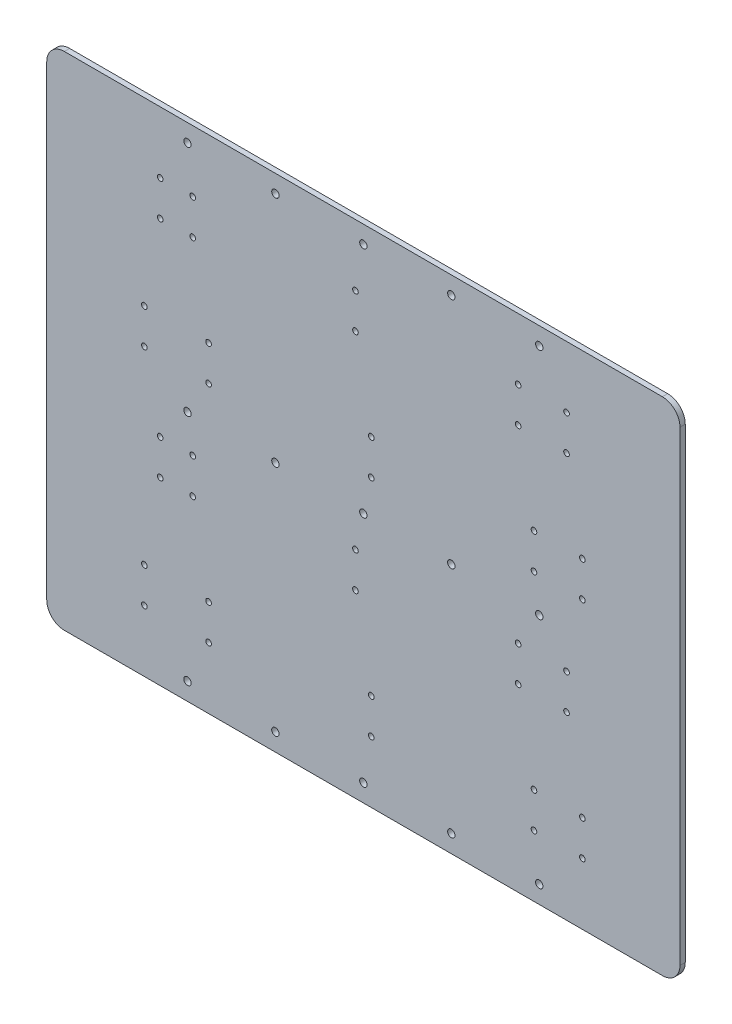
SolidWorks part; units mm, degrees
ref_plane "前视基准面" through (0, 0, 0) normal (0, 0, 1) x (1, 0, 0)
ref_plane "上视基准面" through (0, 0, 0) normal (0, 1, 0) x (1, 0, 0)
ref_plane "右视基准面" through (0, 0, 0) normal (1, 0, 0) x (0, 0, -1)
sketch "草图1" plane through (0, 0, 0) normal (0, 0, 1) x (1, 0, 0)
  line L1 (0, 0) -> (360, 0)
  line L2 (0, 0) -> (0, 275)
  line L3 (0, 275) -> (360, 275)
  line L4 (360, 0) -> (360, 275)
  dimension "D1" = 275
  dimension "D2" = 360
extrude "凸台-拉伸1" add sketch "草图1" along normal blind 3
sketch "草图3" plane through (0, 0, 3) normal (0, 0, 1) x (1, 0, 0)
  line L0 (180, 275) -> (180, 0) construction
  line L1 (360, 275) -> (0, 275) construction
  line L2 (0, 0) -> (360, 0) construction
  line L3 (0, 137.5) -> (360, 137.5) construction
  line L4 (0, 275) -> (0, 0) construction
  line L5 (360, 0) -> (360, 275) construction
  line L6 (300, 275) -> (300, 0) construction
  line L7 (60, 275) -> (60, 0) construction
  line L8 (272.5, 275) -> (272.5, 0) construction
  line L9 (87.5, 275) -> (87.5, 0) construction
  circle A0 centre (175.5, 245) radius 1.6
  circle A1 centre (175.5, 225) radius 1.6
  circle A2 centre (184.5, 177.5) radius 1.6
  circle A3 centre (184.5, 157.5) radius 1.6
  circle A4 centre (184.5, 30) radius 1.6
  circle A5 centre (184.5, 50) radius 1.6
  circle A6 centre (175.5, 97.5) radius 1.6
  circle A7 centre (175.5, 117.5) radius 1.6
  circle A8 centre (295.5, 245) radius 1.6
  circle A9 centre (295.5, 225) radius 1.6
  circle A10 centre (304.5, 177.5) radius 1.6
  circle A11 centre (304.5, 157.5) radius 1.6
  circle A12 centre (304.5, 30) radius 1.6
  circle A13 centre (304.5, 50) radius 1.6
  circle A14 centre (295.5, 97.5) radius 1.6
  circle A15 centre (295.5, 117.5) radius 1.6
  circle A16 centre (64.5, 117.5) radius 1.6
  circle A17 centre (64.5, 97.5) radius 1.6
  circle A18 centre (55.5, 50) radius 1.6
  circle A19 centre (55.5, 30) radius 1.6
  circle A20 centre (55.5, 157.5) radius 1.6
  circle A21 centre (55.5, 177.5) radius 1.6
  circle A22 centre (64.5, 225) radius 1.6
  circle A23 centre (64.5, 245) radius 1.6
  circle A56 centre (268, 245) radius 1.6
  circle A57 centre (268, 225) radius 1.6
  circle A58 centre (277, 177.5) radius 1.6
  circle A59 centre (277, 157.5) radius 1.6
  circle A60 centre (277, 30) radius 1.6
  circle A61 centre (277, 50) radius 1.6
  circle A62 centre (268, 97.5) radius 1.6
  circle A63 centre (268, 117.5) radius 1.6
  circle A64 centre (83, 245) radius 1.6
  circle A65 centre (83, 225) radius 1.6
  circle A66 centre (92, 177.5) radius 1.6
  circle A67 centre (92, 157.5) radius 1.6
  circle A68 centre (92, 30) radius 1.6
  circle A69 centre (92, 50) radius 1.6
  circle A70 centre (83, 97.5) radius 1.6
  circle A71 centre (83, 117.5) radius 1.6
  point P20 (180, 137.5)
  point P32 (180, 137.5)
  point P42 (300, 137.5)
  point P51 (300, 137.5)
  point P68 (60, 137.5)
  point P81 (272.5, 137.5)
  point P90 (272.5, 137.5)
  point P101 (87.5, 137.5)
  point P110 (87.5, 137.5)
  dimension "D1" = 4.5
  dimension "D2" = 4.5
  dimension "D3" = 30
  dimension "D4" = 20
  dimension "D5" = 3.2
  dimension "D6" = 3.2
  dimension "D7" = 20
  dimension "D8" = 20
  dimension "D9" = 3.2
  dimension "D10" = 3.2
  dimension "D11" = 4.5
  dimension "D12" = 4.5
  dimension "D14" = 2
  dimension "D13" = 2
extrude "切除-拉伸1" cut sketch "草图3" against normal blind 3
sketch "草图5" plane through (0, 275, 0) normal (0, 1, 0) x (1, 0, 0)
  line L4 (360, 0) -> (0, 0)
  line L5 (0, 0) -> (0, -3)
  line L6 (0, -3) -> (360, -3)
  line L7 (360, -3) -> (360, 0)
  line L8 (360, 0) -> (0, 0)
  line L9 (0, 0) -> (0, -3)
  line L10 (0, -3) -> (360, -3)
  line L11 (360, -3) -> (360, 0)
  dimension "D1" = 0
extrude "凸台-拉伸2" add sketch "草图5" along normal blind 5
sketch "草图6" plane through (0, 0, 0) normal (0, -1, 0) x (1, 0, 0)
  line L4 (0, 0) -> (360, 0)
  line L5 (360, 0) -> (360, 3)
  line L6 (360, 3) -> (0, 3)
  line L7 (0, 3) -> (0, 0)
  line L8 (0, 0) -> (360, 0)
  line L9 (360, 0) -> (360, 3)
  line L10 (360, 3) -> (0, 3)
  line L11 (0, 3) -> (0, 0)
  dimension "D1" = 0
extrude "凸台-拉伸3" add sketch "草图6" along normal blind 5
sketch "草图7" plane through (0, 0, 3) normal (0, 0, 1) x (1, 0, 0)
  line L1 (0, 280) -> (0, -5) construction
  line L2 (360, -5) -> (0, -5) construction
  line L3 (180, -5) -> (180, 10.3036) construction
  line L4 (0, 137.5) -> (192.631, 137.5) construction
  line L5 (180, 280) -> (180, 264.6964) construction
  line L6 (180, 127.5) -> (180, 142.8036) construction
  circle A0 centre (180, 5) radius 2.1
  circle A1 centre (130, 5) radius 2.1
  circle A2 centre (80, 5) radius 2.1
  circle A3 centre (280, 5) radius 2.1
  circle A4 centre (230, 5) radius 2.1
  circle A5 centre (230, 270) radius 2.1
  circle A6 centre (280, 270) radius 2.1
  circle A7 centre (80, 270) radius 2.1
  circle A8 centre (130, 270) radius 2.1
  circle A9 centre (180, 270) radius 2.1
  circle A10 centre (280, 137.5) radius 2.1
  circle A11 centre (80, 137.5) radius 2.1
  circle A12 centre (230, 137.5) radius 2.1
  circle A13 centre (130, 137.5) radius 2.1
  circle A14 centre (180, 137.5) radius 2.1
  dimension "D1" = 180
  dimension "D2" = 10
  dimension "D3" = 4.2
  dimension "D4" = 3
extrude "切除-拉伸2" cut sketch "草图7" against normal blind 10
fillet "圆角1" radius 10 4 edges at (0, -5, 1.5) (360, -5, 1.5) (360, 280, 1.5) (0, 280, 1.5)
